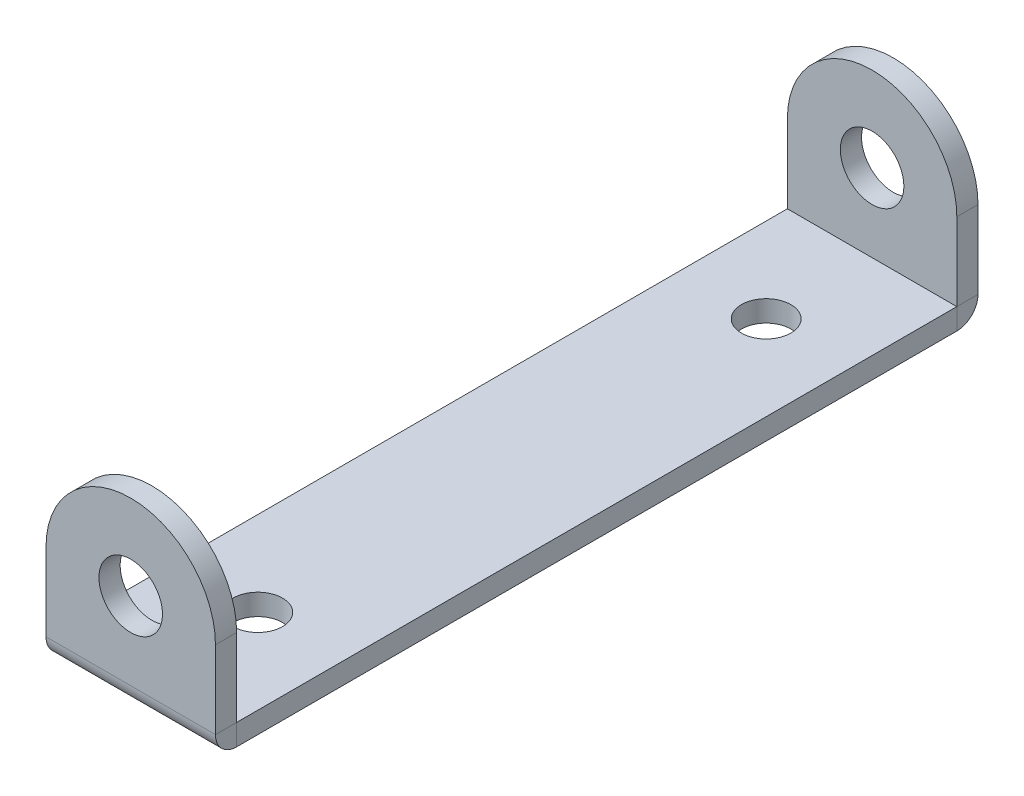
SolidWorks part; units mm, degrees
ref_plane "Front" through (0, 0, 0) normal (0, 0, 1) x (1, 0, 0)
ref_plane "Top" through (0, 0, 0) normal (0, 1, 0) x (1, 0, 0)
ref_plane "Right" through (0, 0, 0) normal (1, 0, 0) x (0, 0, -1)
sketch "Sketch1" plane through (0, 0, 0) normal (0, 1, 0) x (1, 0, 0)
  line L1 (6, 0) -> (6, 68)
  line L2 (-6, 0) -> (-6, 68)
  circle A0 centre (0, 68) radius 2.25
  circle A1 centre (0, 0) radius 2.25
  arc A2 (6, 68) -> (-6, 68) centre (0, 68) ccw
  arc A3 (-6, 0) -> (6, 0) centre (0, 0) ccw
  circle A4 centre (0, 52) radius 1.75
  circle A5 centre (0, 16) radius 1.75
sheet metal parameters "Sheet-Metal1" thickness 1.5 parameters "D1"=0
base flange "Base-Flange1" sketch "Sketch1" thickness 1.5 reverse thickness direction yes parameters "D1"=0
sketch "Sketch3" plane through (0, 1.5, 0) normal (0, 1, 0) x (-1, 0, 0)
  line L3 (6, -7) -> (-6, -7)
  line L4 (6, -61) -> (-6, -61)
sketched bend "Sketched Bend2" parameters "D1"=0
bend "SketchBend1" bend radius 0 bend angle 90 parameters "D5"=1
bend "SketchBend2" bend radius 0 bend angle 90 parameters "D5"=2
flat pattern "Flat-Pattern1"
sketch "Bend-Lines1" plane through (0, 1.5, 0) normal (0, 1, 0) x (-1, 0, 0)
  line L0 (6, -60.995) -> (-6, -60.995) construction
  line L1 (-6, -7.005) -> (6, -7.005) construction
bend of the flat pattern "Flatten-<SketchBend1>1"
bend of the flat pattern "Flatten-<SketchBend2>1"
